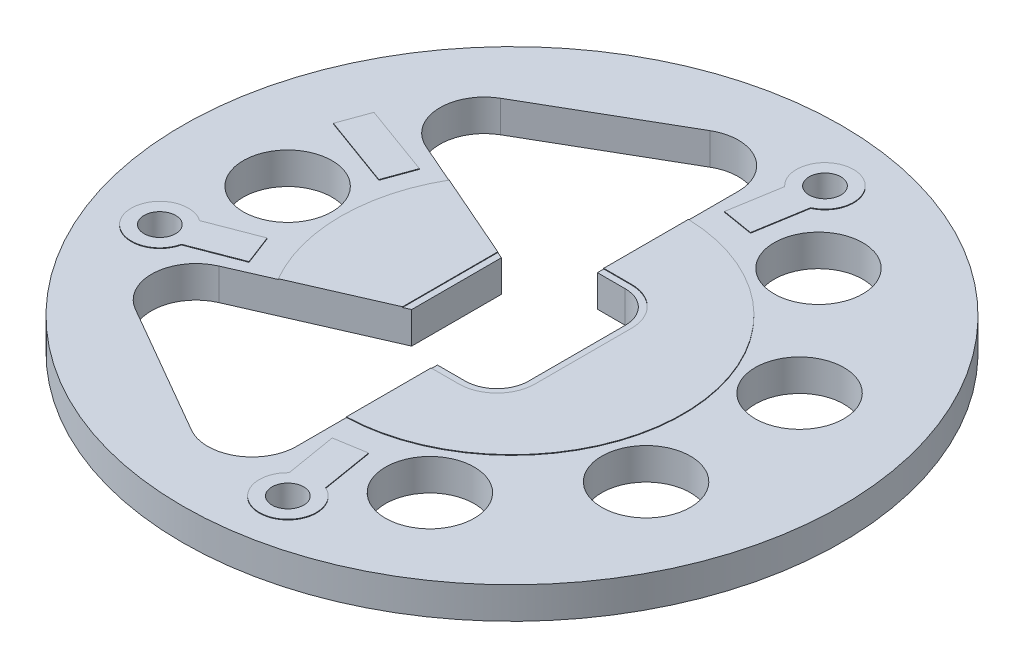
SolidWorks part; units mm, degrees
ref_plane "Front Plane" through (0, 0, 0) normal (0, 0, 1) x (1, 0, 0)
ref_plane "Top Plane" through (0, 0, 0) normal (0, 1, 0) x (1, 0, 0)
ref_plane "Right Plane" through (0, 0, 0) normal (1, 0, 0) x (0, 0, -1)
sketch "Sketch1" plane through (0, 0, 0) normal (0, 1, 0) x (1, 0, 0)
  circle A0 centre (0, 0) radius 6.604
  dimension "D1" = 13.208
extrude "Boss-Extrude1" add sketch "Sketch1" along normal blind 0.635
sketch "Sketch2" plane through (0, 0.635, 0) normal (0, 1, 0) x (1, 0, 0)
  line L0 (0.92, 0.9679) -> (0.92, 0.6111) construction
  line L1 (0.666, 1.6029) -> (-0.477, 1.6029)
  line L2 (1.301, 0.9679) -> (1.301, -0.9679)
  line L3 (0.666, -1.6029) -> (-0.477, -1.6029)
  line L4 (-1.112, 0.9679) -> (-1.112, -0.9679)
  line L5 (1.6731, 1.2219) -> (-0.477, 1.2219) construction
  line L6 (-0.477, -1.2219) -> (1.6731, -1.2219) construction
  line L7 (-0.731, 0.9679) -> (-0.731, -0.9679) construction
  arc A0 (-0.477, -1.6029) -> (-1.112, -0.9679) centre (-0.477, -0.9679) cw
  arc A1 (-0.477, 1.6029) -> (-1.112, 0.9679) centre (-0.477, 0.9679) ccw
  arc A2 (1.301, -0.9679) -> (0.666, -1.6029) centre (0.666, -0.9679) cw
  arc A3 (0.666, 1.6029) -> (1.301, 0.9679) centre (0.666, 0.9679) cw
  dimension "D1" = 0.635
  dimension "pedestal_to_glass_setback" = 0.381
extrude "Cut-Extrude1" cut sketch "Sketch2" against normal through all
sketch "Sketch3" plane through (0, 0, 0) normal (0, -1, 0) x (1, 0, 0)
  line L8 (1.809, -0.9679) -> (1.809, 0.9679)
  line L9 (-0.477, -2.1109) -> (0.666, -2.1109)
  line L10 (-1.62, 0.9679) -> (-1.62, -0.9679)
  line L11 (0.666, 2.1109) -> (-0.477, 2.1109)
  line L12 (1.809, -0.9679) -> (1.809, 0.9679)
  line L13 (-0.477, -2.1109) -> (0.666, -2.1109)
  line L14 (-1.62, 0.9679) -> (-1.62, -0.9679)
  line L15 (0.666, 2.1109) -> (-0.477, 2.1109)
  arc A8 (1.809, 0.9679) -> (0.666, 2.1109) centre (0.666, 0.9679) ccw
  arc A9 (0.666, -2.1109) -> (1.809, -0.9679) centre (0.666, -0.9679) ccw
  arc A10 (-1.62, -0.9679) -> (-0.477, -2.1109) centre (-0.477, -0.9679) ccw
  arc A11 (-0.477, 2.1109) -> (-1.62, 0.9679) centre (-0.477, 0.9679) ccw
  arc A12 (1.809, 0.9679) -> (0.666, 2.1109) centre (0.666, 0.9679) ccw
  arc A13 (0.666, -2.1109) -> (1.809, -0.9679) centre (0.666, -0.9679) ccw
  arc A14 (-1.62, -0.9679) -> (-0.477, -2.1109) centre (-0.477, -0.9679) ccw
  arc A15 (-0.477, 2.1109) -> (-1.62, 0.9679) centre (-0.477, 0.9679) ccw
  dimension "D1" = 0.508
extrude "Cut-Extrude2" [suppressed] cut sketch "Sketch3" against normal blind 0.508
sketch "Sketch6" plane through (0, 0.635, 0) normal (0, 1, 0) x (1, 0, 0)
  line L0 (0, 0) -> (0, 2.5228) construction
  circle A0 centre (-4.4958, 0) radius 0.889
  dimension "D2" = 1.778
  dimension "D1" = 8.9916
extrude "Cut-Extrude3" cut sketch "Sketch6" against normal up to next
sketch "Sketch7" plane through (0, 0, 0) normal (0, 0, 1) x (1, 0, 0)
  line L0 (0, 0) -> (0, 3.3118) construction
pattern_circular "CirPattern1" count 9 over 360 about axis through (0, 0, 0) along (0, 1, 0) of "Cut-Extrude3"
sketch "Sketch4" plane through (0, 0, 0) normal (0, -1, 0) x (1, 0, 0)
  line L0 (2.825, 0.7635) -> (2.825, 2.0335)
  line L1 (2.4466, 0.0055) -> (0.2707, 0.0055) construction
  line L2 (2.571, 1.8656) -> (0.4632, 2.7632)
  line L3 (0.7374, 2.9225) -> (2.825, 2.0335)
  line L4 (0.7374, 2.9225) -> (0.9652, 4.8838)
  line L5 (0.7129, 4.9131) -> (0.4632, 2.7632)
  line L7 (-1.366, -0.312) -> (-2.636, -0.312)
  line L8 (2.571, -1.3875) -> (1.555, -1.3875)
  line L9 (1.555, 1.3985) -> (1.555, 0.7635)
  line L10 (1.555, 0.7635) -> (2.825, 0.7635)
  line L11 (-2.636, 0.323) -> (-1.366, 0.323)
  line L12 (0.2707, 0.1405) -> (0.2707, -0.1295) construction
  line L13 (2.571, -1.8546) -> (2.571, -1.3875)
  line L14 (0.1895, 0.7635) -> (1.635, 0.7635) construction
  line L16 (2.571, 1.8656) -> (2.571, 1.3985)
  line L17 (2.571, 1.3985) -> (1.555, 1.3985)
  line L18 (1.555, -0.7525) -> (2.825, -0.7525)
  line L19 (1.555, -1.3875) -> (1.555, -0.7525)
  line L20 (0.7129, -4.9021) -> (0.4632, -2.7522)
  line L21 (0.7374, -2.9115) -> (0.9652, -4.8728)
  line L22 (0.7374, -2.9115) -> (2.825, -2.0225)
  line L23 (2.571, -1.8546) -> (0.4632, -2.7522)
  line L24 (2.825, -0.7525) -> (2.825, -2.0225)
  line L25 (-1.366, 0.323) -> (-1.366, -0.312)
  line L26 (-2.636, -0.312) -> (-3.2796, 1.1626)
  line L27 (-3.2796, 1.1626) -> (-4.6786, 1.6718)
  line L28 (-4.5918, 1.9105) -> (-3.0903, 1.364)
  line L29 (-3.0903, 1.364) -> (-2.636, 0.323)
  line L30 (-5.0974, 1.9593) -> (0.2707, 0.0055) construction
  line L31 (0.2707, 0.0055) -> (-4.594, 0.0055) construction
  line L32 (0.8958, 5.387) -> (0.2707, 0.0055) construction
  line L33 (0.2707, 0.0055) -> (-0.7807, 4.4275) construction
  line L36 (-1.112, -0.9679) -> (-1.112, 0.9679) construction
  line L38 (1.301, 0.9679) -> (1.301, -0.9679) construction
  arc A0 (0.9652, 4.8838) -> (0.7129, 4.9131) centre (0.8958, 5.387) ccw
  arc A1 (0.9652, -4.8728) -> (0.7129, -4.9021) centre (0.8958, -5.376) cw
  arc A2 (-4.6786, 1.6718) -> (-4.5918, 1.9105) centre (-5.0974, 1.9593) cw
  circle A4 centre (0, 0) radius 6.604 construction
  point P12 (0.2707, 0.0055)
  point P39 (-1.366, 0.0055)
  dimension "D1" = 0.508
  dimension "D2" = 1.27
  dimension "D4" = 0.635
  dimension "D7" = 0.635
  dimension "D8" = 0.635
  dimension "D3" = 1.27
  dimension "tracewidth" = 0.254
  dimension "D5" = 20
  dimension "D6" = 0.889
  dimension "D9" = 20
  dimension "D10" = 1.27
  dimension "D11" = 0.127
  dimension "D12" = 0.127
  dimension "D13" = 0.254
  dimension "D14" = 0.254
extrude "bottom side gold" add sketch "Sketch4" along normal blind 0.0127
sketch "Sketch8" plane through (0, -0.0127, 0) normal (0, -1, 0) x (1, 0, 0)
  circle A0 centre (0.8958, 5.387) radius 0.3175
  circle A1 centre (-5.0974, 1.9593) radius 0.3175
  circle A2 centre (0.8958, -5.376) radius 0.3175
  arc A3 (0.9652, 4.8838) -> (0.7129, 4.9131) centre (0.8958, 5.387) ccw construction
  arc A4 (0.7129, -4.9021) -> (0.9652, -4.8728) centre (0.8958, -5.376) ccw construction
  arc A5 (-4.5918, 1.9105) -> (-4.6786, 1.6718) centre (-5.0974, 1.9593) ccw construction
  dimension "D1" = 0.635
extrude "gold plated holes" cut sketch "Sketch8" against normal up to next
sketch "Sketch9" plane through (0, 0.635, 0) normal (0, 1, 0) x (1, 0, 0)
  line L0 (1.1309, 4.8551) -> (0.9585, 3.8205)
  line L1 (0.9585, 3.8205) -> (0.3321, 3.9249)
  line L2 (0.3321, 3.9249) -> (0.5045, 4.9595)
  line L3 (-4.5399, -2.0852) -> (-3.561, -1.7089)
  line L4 (-3.561, -1.7089) -> (-3.7888, -1.1162)
  line L5 (-3.7888, -1.1162) -> (-4.7678, -1.4925)
  line L6 (0.5046, -4.9704) -> (0.3326, -3.9358)
  line L7 (0.3326, -3.9358) -> (0.959, -3.8316)
  line L8 (0.959, -3.8316) -> (1.131, -4.8662)
  line L9 (0.8958, -5.387) -> (0.6458, -3.8837) construction
  line L10 (-5.0974, -1.9593) -> (-3.6749, -1.4126) construction
  line L11 (0.8958, 5.376) -> (0.6453, 3.8727) construction
  line L12 (-4.8996, 2.1339) -> (-3.4675, 1.6127)
  line L13 (-3.4675, 1.6127) -> (-3.6847, 1.016)
  line L14 (-3.6847, 1.016) -> (-5.1168, 1.5372)
  line L15 (-5.1168, 1.5372) -> (-4.8996, 2.1339)
  line L20 (-2.7414, 0) -> (-7.2933, 0) construction
  line L29 (0.666, 1.7299) -> (-0.477, 1.7299)
  line L30 (-1.239, 0.9679) -> (-1.239, -0.9679)
  line L31 (-0.477, -1.7299) -> (0.666, -1.7299)
  line L32 (1.428, -0.9679) -> (1.428, 0.9679)
  line L33 (0.666, 1.7299) -> (-0.477, 1.7299)
  line L34 (-1.239, 0.9679) -> (-1.239, -0.9679)
  line L35 (-0.477, -1.7299) -> (0.666, -1.7299)
  line L36 (1.428, -0.9679) -> (1.428, 0.9679)
  arc A0 (0.5046, -4.9704) -> (1.131, -4.8662) centre (0.8958, -5.387) ccw
  arc A1 (-4.7678, -1.4925) -> (-4.5399, -2.0852) centre (-5.0974, -1.9593) ccw
  arc A2 (1.1309, 4.8551) -> (0.5045, 4.9595) centre (0.8958, 5.376) ccw
  circle A4 centre (0.8958, -5.387) radius 0.3175 construction
  circle A5 centre (-5.0974, -1.9593) radius 0.3175 construction
  circle A7 centre (0.8958, -5.387) radius 0.3175
  circle A8 centre (-5.0974, -1.9593) radius 0.3175
  circle A9 centre (0.8958, 5.376) radius 0.3175
  circle A10 centre (0, 0) radius 3.429
  circle A11 centre (0, 0) radius 3.429
  circle A13 centre (0.8958, 5.376) radius 0.3175 construction
  arc A23 (1.428, 0.9679) -> (0.666, 1.7299) centre (0.666, 0.9679) ccw
  arc A24 (-0.477, 1.7299) -> (-1.239, 0.9679) centre (-0.477, 0.9679) ccw
  arc A25 (-1.239, -0.9679) -> (-0.477, -1.7299) centre (-0.477, -0.9679) ccw
  arc A26 (0.666, -1.7299) -> (1.428, -0.9679) centre (0.666, -0.9679) ccw
  arc A27 (1.428, 0.9679) -> (0.666, 1.7299) centre (0.666, 0.9679) ccw
  arc A28 (-0.477, 1.7299) -> (-1.239, 0.9679) centre (-0.477, 0.9679) ccw
  arc A29 (-1.239, -0.9679) -> (-0.477, -1.7299) centre (-0.477, -0.9679) ccw
  arc A30 (0.666, -1.7299) -> (1.428, -0.9679) centre (0.666, -0.9679) ccw
  point P28 (0.6453, 3.8727)
  point P31 (-3.6749, -1.4126)
  point P32 (0.6458, -3.8837)
  dimension "D6" = 20
  dimension "D11" = 0.635
  dimension "D2" = 0.127
  dimension "D3" = 1.524
  dimension "D4" = 0.635
  dimension "hole_pad_spacing" = 0.254
  dimension "D7" = 1.524
  dimension "D8" = 1.016
  dimension "D9" = 3.81
  dimension "D10" = 0.254
extrude "top side gold" add sketch "Sketch9" along normal blind 0.0127
sketch "Sketch10" plane through (0, 0, 0) normal (0, -1, 0) x (1, 0, 0)
  line L0 (0, 0) -> (0, 1.8024) construction
  line L1 (-3.444, 2.8898) -> (0, 0) construction
  line L2 (-1.1116, 3.4791) -> (-1.1116, -3.5147)
  line L3 (0, 0) -> (-4.4958, 0) construction
  line L4 (0, 0) -> (-3.444, -2.8898) construction
  circle A0 centre (-3.444, 2.8898) radius 1.143
  arc A1 (-0.9483, 5.378) -> (-0.9447, -5.3787) centre (0, 0) cw
  circle A2 centre (0, 0) radius 6.604 construction
  circle A3 centre (0, 0) radius 6.604
  arc A4 (-1.1116, -3.5147) -> (-1.1489, -3.5709) centre (-1.1726, -3.5147) cw
  arc A5 (-1.1116, 3.4791) -> (-1.1493, 3.5355) centre (-1.1726, 3.4791) ccw
  circle A6 centre (-4.4958, 0) radius 1.143
  arc A8 (-0.9483, 5.378) -> (-1.1493, 3.5355) centre (-0.7807, 4.4275) ccw
  circle A9 centre (0, 0) radius 4.4958 construction
  arc A13 (-1.1489, -3.5709) -> (-0.9447, -5.3787) centre (-0.7807, -4.4447) ccw
  circle A14 centre (-3.444, -2.8898) radius 1.143
  dimension "D1" = 5.461
  dimension "D2" = 2.286
  dimension "D4" = 40
  dimension "D3" = 8.9916
  dimension "D5" = 40
extrude "Boss-Extrude4" [suppressed] add sketch "Sketch10" along normal blind 1.27
sketch "Sketch11" [suppressed] plane through (0, 0, 0) normal (0, -1, 0) x (1, 0, 0)
  line L0 (-1.905, -1.778) -> (-1.905, -0.9525)
  line L1 (-0.889, 2.794) -> (2.032, 2.794)
  line L2 (3.048, 1.778) -> (3.048, -1.778)
  line L3 (2.032, -2.794) -> (-0.889, -2.794)
  line L5 (-1.905, 0.9525) -> (-2.413, 0.9525)
  line L6 (-2.921, 0.4445) -> (-2.921, -0.4445)
  line L7 (-2.413, -0.9525) -> (-1.905, -0.9525)
  line L8 (-1.905, 0.9525) -> (-1.905, 1.778)
  circle A0 centre (-4.4958, 0) radius 0.889
  circle A1 centre (-4.4958, 0) radius 0.889 construction
  circle A2 centre (-3.444, 2.8898) radius 0.889
  circle A3 centre (-0.7807, 4.4275) radius 0.889
  circle A4 centre (2.2479, 3.8935) radius 0.889
  circle A5 centre (4.2247, 1.5377) radius 0.889
  circle A6 centre (4.2247, -1.5377) radius 0.889
  circle A7 centre (2.2479, -3.8935) radius 0.889
  circle A8 centre (-0.7807, -4.4275) radius 0.889
  circle A9 centre (-3.444, -2.8898) radius 0.889
  circle A10 centre (0, 0) radius 6.604 construction
  circle A11 centre (0, 0) radius 6.604
  arc A12 (2.032, 2.794) -> (3.048, 1.778) centre (2.032, 1.778) cw
  arc A13 (3.048, -1.778) -> (2.032, -2.794) centre (2.032, -1.778) cw
  arc A14 (-1.905, -1.778) -> (-0.889, -2.794) centre (-0.889, -1.778) ccw
  arc A15 (-1.905, 1.778) -> (-0.889, 2.794) centre (-0.889, 1.778) cw
  circle A16 centre (0, 0) radius 2.413 construction
  arc A17 (-2.413, 0.9525) -> (-2.921, 0.4445) centre (-2.413, 0.4445) ccw
  arc A18 (-2.921, -0.4445) -> (-2.413, -0.9525) centre (-2.413, -0.4445) ccw
  point P48 (-2.921, 0)
  dimension "D1" = 0
  dimension "D7" = 1.016
  dimension "D8" = 4.826
  dimension "D10" = 1.016
  dimension "D4" = 0.508
  dimension "D3" = 1.905
  dimension "D5" = 2.794
  dimension "D6" = 2.794
  dimension "D9" = 1.905
  dimension "D11" = 3.048
  dimension "D2" = 9
extrude "Boss-Extrude5" [suppressed] add sketch "Sketch11" along normal blind 0.762
sketch "top_wirebond_contact_points" plane through (0, 0.6477, 0) normal (0, 1, 0) x (1, 0, 0)
  line L0 (0.9585, 3.8205) -> (1.1309, 4.8551) construction
  line L1 (0.3321, 3.9249) -> (0.9585, 3.8205) construction
  line L2 (-3.6847, 1.016) -> (-3.4675, 1.6127) construction
  line L3 (-4.8996, 2.1339) -> (-5.1168, 1.5372) construction
  line L4 (-3.4675, 1.6127) -> (-4.8996, 2.1339) construction
  line L5 (-3.4675, 1.6127) -> (-4.8996, 2.1339) construction
  line L6 (-3.561, -1.7089) -> (-3.7888, -1.1162) construction
  line L7 (-3.7888, -1.1162) -> (-4.7678, -1.4925) construction
  line L9 (0.959, -3.8316) -> (0.3326, -3.9358) construction
  line L10 (0.3326, -3.9358) -> (0.5046, -4.9704) construction
  point P0 (-4.0535, 1.4881)
  point P1 (-4.149, -1.5948)
  point P2 (0.7288, 4.3738)
  point P3 (-4.5309, 1.6618)
  point P4 (0.7291, -4.3848)
  point P9 (-3.5761, 1.3144)
  dimension "D1" = 0.3175
  dimension "D2" = 0.508
  dimension "D3" = 0.508
  dimension "D4" = 0.508
  dimension "D5" = 0.3175
  dimension "D6" = 0.3175
  dimension "D7" = 0.508
  dimension "D8" = 0.3175
  dimension "D9" = 0.508
  dimension "D10" = 0.3175
sketch "bottom_wirebond_contact_points" [suppressed] plane through (0, -0.0127, 0) normal (0, -1, 0) x (1, 0, 0)
  line L0 (-1.747, -0.312) -> (-1.747, 0.323) construction
  line L1 (-1.747, 0.323) -> (-2.763, 0.323) construction
  line L2 (1.936, -1.4759) -> (1.936, 1.4759) construction
  line L3 (1.936, -1.3875) -> (2.698, -1.3875) construction
  line L4 (1.936, 1.3985) -> (1.936, 0.7635) construction
  line L5 (2.698, 1.3985) -> (1.936, 1.3985) construction
  point P0 (2.444, -1.07)
  point P1 (-2.255, 0.0055)
  point P2 (2.444, 1.081)
  point P11 (1.936, 1.081)
  dimension "D1" = 0.508
  dimension "D2" = 0.3175
  dimension "D3" = 0.508
  dimension "D4" = 0.3175
  dimension "D5" = 0.508
  dimension "D6" = 0.3175
sketch "Sketch12" plane through (0, 0, 0) normal (0, -1, 0) x (1, 0, 0)
  line L0 (-3.8885, 3.6597) -> (-1.2252, 5.1974)
  line L1 (0.1083, 4.4275) -> (0.1083, 1.6029)
  line L2 (0.1083, 1.6029) -> (-1.112, 0.8984)
  line L3 (-1.112, 0.8984) -> (-3.8005, 2.0755)
  line L6 (0, 0) -> (-4.6169, 0) construction
  line L7 (-1.112, -0.8984) -> (-3.8005, -2.0755)
  line L8 (0.1083, -1.6029) -> (-1.112, -0.8984)
  line L9 (0.1083, -4.4275) -> (0.1083, -1.6029)
  line L10 (-3.8885, -3.6597) -> (-1.2252, -5.1974)
  line L12 (-0.477, 1.6029) -> (0.666, 1.6029) construction
  line L13 (-1.112, -0.9679) -> (-1.112, 0.9679) construction
  circle A0 centre (-3.444, 2.8898) radius 0.889 construction
  circle A1 centre (-0.7807, 4.4275) radius 0.889 construction
  arc A2 (-3.8885, 3.6597) -> (-3.8005, 2.0755) centre (-3.444, 2.8898) ccw
  arc A3 (0.1083, 4.4275) -> (-1.2252, 5.1974) centre (-0.7807, 4.4275) ccw
  arc A4 (0.1083, -4.4275) -> (-1.2252, -5.1974) centre (-0.7807, -4.4275) cw
  arc A5 (-3.8885, -3.6597) -> (-3.8005, -2.0755) centre (-3.444, -2.8898) cw
extrude "backside oil ports" cut sketch "Sketch12" against normal up to next
